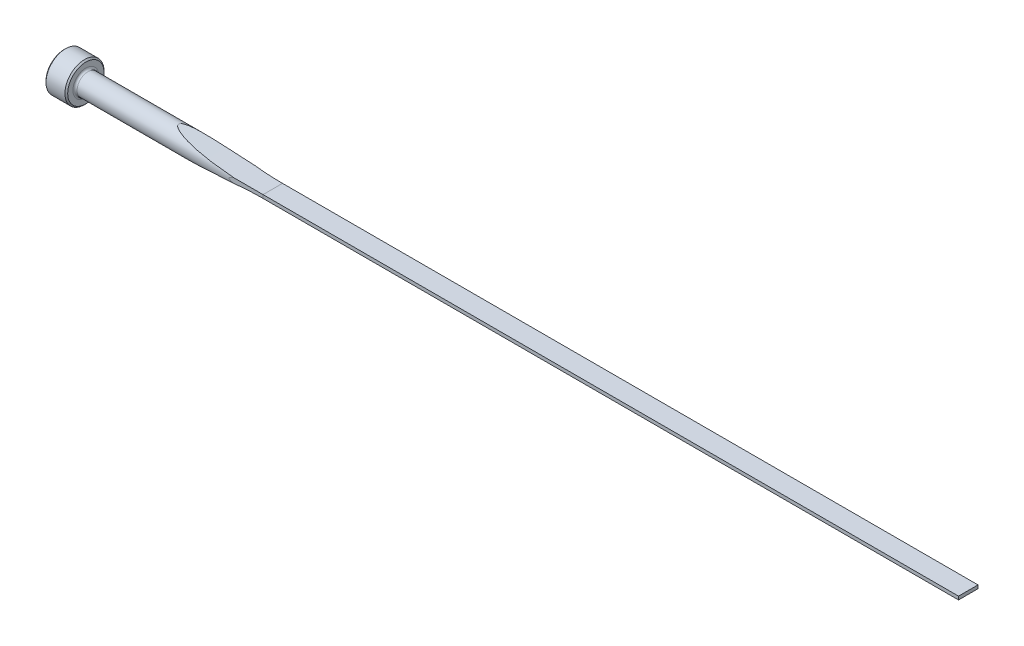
SolidWorks part; units mm, degrees
ref_plane "Front Plane" through (0, 0, 0) normal (0, 0, 1) x (1, 0, 0)
ref_plane "Top Plane" through (0, 0, 0) normal (0, 1, 0) x (1, 0, 0)
ref_plane "Right Plane" through (0, 0, 0) normal (1, 0, 0) x (0, 0, -1)
sketch "Sketch1" plane through (0, 0, 0) normal (0, 0, 1) x (1, 0, 0)
  line L0 (0, 0) -> (167.7268, 0) construction
  line L1 (0, 0) -> (0, 3.5687)
  line L2 (0, 3.5687) -> (3.9624, 3.5687)
  line L3 (3.9624, 3.5687) -> (3.9624, 1.9812)
  line L4 (3.9624, 1.9812) -> (165.1, 1.9812)
  line L5 (165.1, 1.9812) -> (165.1, 0)
  line L6 (165.1, 0) -> (0, 0)
  dimension "D1" = 165.1
  dimension "D2" = 7.1374
  dimension "D3" = 3.9624
  dimension "D4" = 3.9624
revolve "Revolve1" add sketch "Sketch1" angle 360 about L0
sketch "Sketch2" plane through (0, 0, 0) normal (0, 0, 1) x (1, 0, 0)
  line L0 (165.1, 1.9812) -> (165.1, 0.3048)
  line L1 (165.1, -1.9812) -> (165.1, 1.9812) construction
  line L2 (165.1, 0.3048) -> (38.1, 0.3048)
  line L3 (165.1, 1.9812) -> (3.9624, 1.9812) construction
  line L4 (20.9171, 1.9812) -> (165.1, 1.9812)
  line L5 (166.0833, 0) -> (153.1705, 0) construction
  arc A0 (38.1, 0.3048) -> (20.9171, 1.9812) centre (38.1, 89.2048) cw
  dimension "D1" = 88.9
  dimension "D3" = 127
  dimension "D2" = 0.6096
  dimension "D4" = 17.1829
extrude "Cut-Extrude1" cut sketch "Sketch2" against normal through all both and the other way through all
mirror "Mirror1" about plane through (0, 0, 0) normal (0, 1, 0) of "Cut-Extrude1"
sketch "Sketch3" plane through (0, 0, 0) normal (0, 1, 0) x (1, 0, 0)
  line L0 (165.1, 1.9812) -> (165.1, 1.778)
  line L1 (165.1, 1.9576) -> (165.1, -1.9576) construction
  line L2 (165.1, 1.778) -> (38.1, 1.778)
  line L3 (165.1, 1.9812) -> (3.9624, 1.9812) construction
  line L4 (32.0927, 1.9812) -> (165.1, 1.9812)
  line L5 (163.4716, 0) -> (166.2513, 0) construction
  line L6 (38.1, 1.9576) -> (38.1, -1.9576) construction
  arc A0 (38.1, 1.778) -> (32.0927, 1.9812) centre (38.1, 90.678) cw
  dimension "D2" = 88.9
  dimension "D1" = 3.556
extrude "Cut-Extrude2" cut sketch "Sketch3" against normal through all both and the other way through all
mirror "Mirror2" about plane through (0, 0, 0) normal (0, 0, 1) of "Cut-Extrude2"
fillet "Fillet1" radius 0.381 1 edges at (3.9624, 0, 1.9812)
chamfer "Chamfer1" distance 0.254 angle 45 2 edges at (0, 0, 3.5687) (3.9624, 0, 3.5687)
